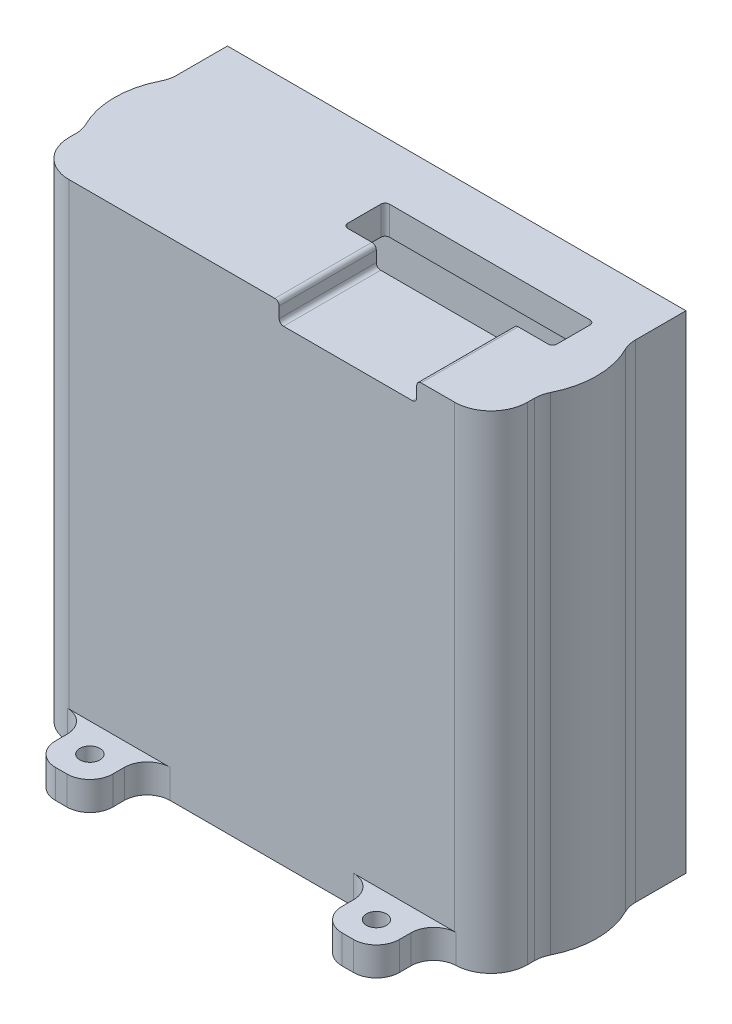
SolidWorks part; units mm, degrees
ref_plane "Front Plane" through (0, 0, 0) normal (0, 0, 1) x (1, 0, 0)
ref_plane "Top Plane" through (0, 0, 0) normal (0, 1, 0) x (1, 0, 0)
ref_plane "Right Plane" through (0, 0, 0) normal (1, 0, 0) x (0, 0, -1)
body saved out of another part "Stock-battery holder-1"
